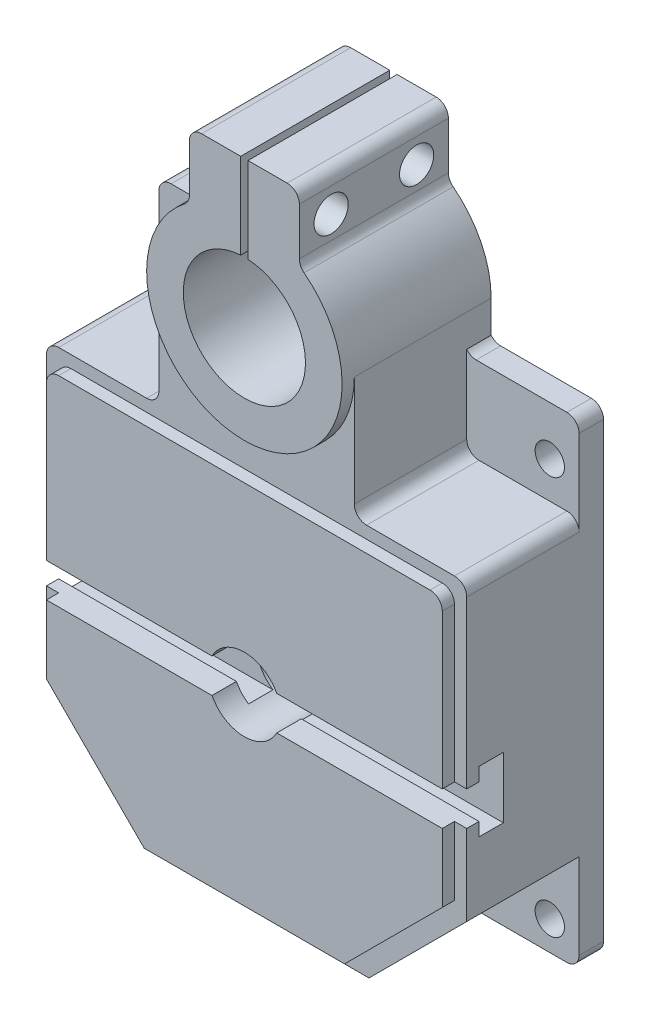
SolidWorks part; units mm, degrees
ref_plane "前视基准面" through (0, 0, 0) normal (0, 0, 1) x (1, 0, 0)
ref_plane "上视基准面" through (0, 0, 0) normal (0, 1, 0) x (1, 0, 0)
ref_plane "右视基准面" through (0, 0, 0) normal (1, 0, 0) x (0, 0, -1)
sketch "草图1" plane through (0, 0, 0) normal (0, 0, 1) x (1, 0, 0)
  line L0 (0, 0) -> (0, 130) construction
  line L1 (0, 0) -> (0, -80) construction
  line L2 (-81, -80) -> (81, -80)
  line L3 (86, -75) -> (86, 110)
  line L4 (81, 115) -> (43.8748, 115)
  line L5 (-86, 110) -> (-86, -75)
  line L6 (0, 130) -> (0, 190) construction
  line L7 (0, 190) -> (17.5, 190)
  line L8 (0, 190) -> (-17.5, 190)
  line L9 (22.5, 185) -> (22.5, 165.6195)
  line L10 (-22.5, 185) -> (-22.5, 165.6195)
  line L11 (-43.8748, 115) -> (-81, 115)
  line L12 (0, 0) -> (-53.3437, 0) construction
  circle A0 centre (0, 130) radius 25
  arc A1 (-86, 110) -> (-81, 115) centre (-81, 110) cw
  arc A2 (81, 115) -> (86, 110) centre (81, 110) cw
  arc A3 (86, -75) -> (81, -80) centre (81, -75) cw
  arc A4 (-81, -80) -> (-86, -75) centre (-81, -75) cw
  arc A5 (-24.4444, 161.6618) -> (-38.9998, 121.1111) centre (0, 130) ccw
  arc A6 (38.9998, 121.1111) -> (24.4444, 161.6618) centre (0, 130) ccw
  arc A7 (17.5, 190) -> (22.5, 185) centre (17.5, 185) cw
  arc A8 (-17.5, 190) -> (-22.5, 185) centre (-17.5, 185) ccw
  arc A9 (-22.5, 165.6195) -> (-24.4444, 161.6618) centre (-27.5, 165.6195) cw
  arc A10 (22.5, 165.6195) -> (24.4444, 161.6618) centre (27.5, 165.6195) ccw
  arc A11 (38.9998, 121.1111) -> (43.8748, 115) centre (43.8748, 120) ccw
  arc A12 (-38.9998, 121.1111) -> (-43.8748, 115) centre (-43.8748, 120) cw
  circle A13 centre (0, 0) radius 15
  circle A14 centre (-74, -68) radius 6
  circle A15 centre (-74, 95) radius 6
  circle A16 centre (74, -68) radius 6
  circle A17 centre (74, 95) radius 6
  point P36 (-37.081, 115)
  dimension "D1" = 5
  dimension "D2" = 5
  dimension "D3" = 74
  dimension "D4" = 74
  dimension "D5" = 68
  dimension "D6" = 95
extrude "凸台-拉伸1" add sketch "草图1" along normal blind 10
sketch "草图2" plane through (0, 0, 10) normal (0, 0, 1) x (1, 0, 0)
  line L0 (-81, -80) -> (81, -80) construction
  line L1 (-46, -80) -> (46, -80)
  line L2 (0, -80) -> (0, 80) construction
  line L3 (-81, 80) -> (-45, 80)
  line L4 (86, -75) -> (86, 110) construction
  line L5 (-86, 110) -> (-86, -75) construction
  line L6 (86, -40) -> (86, 75)
  line L7 (-86, 75) -> (-86, -40)
  line L8 (-86, -40) -> (-46, -80)
  line L9 (46, -80) -> (86, -40)
  line L10 (22.5, 165.6195) -> (22.5, 185) construction
  line L11 (17.5, 190) -> (-17.5, 190) construction
  line L12 (-22.5, 185) -> (-22.5, 165.6195) construction
  line L13 (22.5, 165.6195) -> (22.5, 185)
  line L14 (17.5, 190) -> (-17.5, 190)
  line L15 (-22.5, 185) -> (-22.5, 165.6195)
  line L16 (40, 130) -> (40, 85)
  line L17 (-40, 130) -> (-40, 85)
  line L18 (45, 80) -> (81, 80)
  arc A0 (81, 80) -> (86, 75) centre (81, 75) cw
  arc A1 (-81, 80) -> (-86, 75) centre (-81, 75) ccw
  arc A2 (-24.4444, 161.6618) -> (-22.5, 165.6195) centre (-27.5, 165.6195) ccw construction
  arc A3 (22.5, 165.6195) -> (24.4444, 161.6618) centre (27.5, 165.6195) ccw construction
  arc A4 (22.5, 185) -> (17.5, 190) centre (17.5, 185) ccw construction
  arc A5 (-17.5, 190) -> (-22.5, 185) centre (-17.5, 185) ccw construction
  circle A6 centre (0, 130) radius 25 construction
  arc A7 (-24.4444, 161.6618) -> (-22.5, 165.6195) centre (-27.5, 165.6195) ccw
  arc A8 (22.5, 165.6195) -> (24.4444, 161.6618) centre (27.5, 165.6195) ccw
  arc A9 (22.5, 185) -> (17.5, 190) centre (17.5, 185) ccw
  arc A10 (-17.5, 190) -> (-22.5, 185) centre (-17.5, 185) ccw
  circle A11 centre (0, 130) radius 25
  arc A12 (-24.4444, 161.6618) -> (-40, 130) centre (0, 130) ccw
  arc A13 (40, 130) -> (24.4444, 161.6618) centre (0, 130) ccw
  arc A14 (40, 85) -> (45, 80) centre (45, 85) ccw
  arc A15 (-40, 85) -> (-45, 80) centre (-45, 85) cw
  circle A16 centre (0, 0) radius 15 construction
  circle A17 centre (0, 0) radius 15
  point P17 (-86, -80)
  point P20 (86, -80)
  dimension "D1" = 5
  dimension "D2" = 5
extrude "凸台-拉伸6" add sketch "草图2" along normal blind 46
sketch "草图3" plane through (0, 0, 10) normal (0, 0, -1) x (-1, 0, 0)
  line L0 (-40, 130) -> (-40, 116.84) construction
  line L1 (40, 116.84) -> (40, 130) construction
  line L2 (-40, 130) -> (-40, 116.84)
  line L3 (40, 116.84) -> (40, 130)
  arc A0 (-40, 116.84) -> (-38.9998, 121.1111) centre (-43.8748, 120) ccw construction
  arc A1 (-40, 130) -> (-38.9998, 121.1111) centre (0, 130) ccw construction
  arc A2 (38.9998, 121.1111) -> (40, 130) centre (0, 130) ccw construction
  arc A3 (38.9998, 121.1111) -> (40, 116.84) centre (43.8748, 120) ccw construction
  arc A4 (-40, 116.84) -> (-38.9998, 121.1111) centre (-43.8748, 120) ccw
  arc A5 (-40, 130) -> (-38.9998, 121.1111) centre (0, 130) ccw
  arc A6 (38.9998, 121.1111) -> (40, 130) centre (0, 130) ccw
  arc A7 (38.9998, 121.1111) -> (40, 116.84) centre (43.8748, 120) ccw
extrude "凸台-拉伸7" add sketch "草图3" along normal blind 10
sketch "草图4" plane through (0, 0, 56) normal (0, 0, 1) x (1, 0, 0)
  line L0 (0, 0) -> (81, 0) construction
  line L1 (81, -35) -> (81, 70)
  line L2 (76, 75) -> (-76, 75)
  line L3 (-81, 70) -> (-81, -35)
  line L4 (-41, -75) -> (41, -75)
  line L5 (-81, -35) -> (-41, -75)
  line L6 (41, -75) -> (81, -35)
  line L7 (22.5, 165.6195) -> (22.5, 185) construction
  line L8 (17.5, 190) -> (-17.5, 190) construction
  line L9 (-22.5, 185) -> (-22.5, 165.6195) construction
  line L10 (22.5, 165.6195) -> (22.5, 185)
  line L11 (17.5, 190) -> (-17.5, 190)
  line L12 (-22.5, 185) -> (-22.5, 165.6195)
  arc A0 (-81, 70) -> (-76, 75) centre (-76, 70) cw
  arc A1 (81, 70) -> (76, 75) centre (76, 70) ccw
  arc A2 (-81, -70) -> (-76, -75) centre (-76, -70) ccw
  arc A3 (22.5, 165.6195) -> (24.4444, 161.6618) centre (27.5, 165.6195) ccw construction
  arc A4 (22.5, 185) -> (17.5, 190) centre (17.5, 185) ccw construction
  arc A5 (-17.5, 190) -> (-22.5, 185) centre (-17.5, 185) ccw construction
  arc A6 (-24.4444, 161.6618) -> (-22.5, 165.6195) centre (-27.5, 165.6195) ccw construction
  circle A7 centre (0, 130) radius 25 construction
  circle A8 centre (0, 0) radius 15 construction
  arc A9 (22.5, 165.6195) -> (24.4444, 161.6618) centre (27.5, 165.6195) ccw
  arc A10 (22.5, 185) -> (17.5, 190) centre (17.5, 185) ccw
  arc A11 (-17.5, 190) -> (-22.5, 185) centre (-17.5, 185) ccw
  arc A12 (-24.4444, 161.6618) -> (-22.5, 165.6195) centre (-27.5, 165.6195) ccw
  circle A13 centre (0, 130) radius 25
  circle A14 centre (0, 0) radius 15
  arc A15 (-24.4444, 161.6618) -> (24.4444, 161.6618) centre (0, 130) ccw
  point P7 (81, -75)
  point P15 (-81, -75)
  dimension "D1" = 5
extrude "凸台-拉伸8" add sketch "草图4" along normal blind 5
sketch "草图5" plane through (0, 0, 0) normal (0, 0, -1) x (-1, 0, 0)
  line L0 (0, 0) -> (76, 0) construction
  line L1 (76, 65) -> (76, -30)
  line L2 (36, -70) -> (-36, -70)
  line L3 (-76, -30) -> (-76, 65)
  line L4 (-71, 70) -> (-35, 70)
  line L5 (-36, -70) -> (-76, -30)
  line L6 (76, -30) -> (36, -70)
  line L7 (0, 70) -> (0, 95) construction
  line L8 (0, 95) -> (25, 95)
  line L9 (0, 95) -> (-25, 95)
  line L10 (-30, 90) -> (-30, 75)
  line L11 (30, 90) -> (30, 75)
  line L12 (35, 70) -> (71, 70)
  arc A0 (71, 70) -> (76, 65) centre (71, 65) cw
  arc A1 (-76, 65) -> (-71, 70) centre (-71, 65) cw
  arc A2 (25, 95) -> (30, 90) centre (25, 90) cw
  arc A3 (-30, 90) -> (-25, 95) centre (-25, 90) cw
  arc A4 (30, 75) -> (35, 70) centre (35, 75) ccw
  arc A5 (-30, 75) -> (-35, 70) centre (-35, 75) cw
  point P4 (76, -70)
  point P5 (-76, -70)
  dimension "D1" = 5
  dimension "D2" = 5
extrude "切除-拉伸2" cut sketch "草图5" against normal blind 50
sketch "草图6" plane through (0, 0, 50) normal (0, 0, -1) x (-1, 0, 0)
  line L1 (-76, 20) -> (76, 20)
  line L2 (-76, 20) -> (-76, -20)
  line L3 (-76, -20) -> (76, -20)
  line L4 (76, 20) -> (76, -20)
  line L5 (-76, 20) -> (76, -20) construction
  line L6 (-76, -20) -> (76, 20) construction
  circle A0 centre (0, 0) radius 15 construction
  circle A1 centre (0, 0) radius 15
  point P0 (0, 0)
  dimension "D1" = 40
  dimension "D2" = 152
extrude "凸台-拉伸9" add sketch "草图6" along normal blind 20
fillet "圆角1" radius 10 4 edges at (-76, 20, 40) (-76, -20, 40) (76, -20, 40) (76, 20, 40)
sketch "草图7" plane through (-86, 0, 0) normal (-1, 0, 0) x (0, 0, 1)
  line L2 (0, 0) -> (41, 0) construction
  line L3 (41, 12.5) -> (41, -12.5)
  line L4 (41, -12.5) -> (51, -12.5) construction
  line L5 (51, -12.5) -> (51, -7)
  line L6 (51, -7) -> (62, -7)
  line L7 (51, 12.5) -> (51, 7)
  line L8 (51, 7) -> (62, 7)
  line L9 (51, 12.5) -> (41, 12.5)
  line L10 (41, -12.5) -> (51, -12.5)
  line L11 (62, 7) -> (62, -7)
  dimension "D1" = 11
extrude "切除-拉伸4" cut sketch "草图7" against normal through all contours L3 L10 L5 L6 L8 L7 L9 M9 | L11 L8 L6 M9
sketch "草图8" plane through (0, 190, 0) normal (0, 1, 0) x (1, 0, 0)
  line L0 (0, 0) -> (0, -61) construction
  line L1 (17.5, 0) -> (-17.5, 0) construction
  line L3 (1.5, 0.5) -> (-1.5, 0.5)
  line L4 (1.5, 0.5) -> (1.5, -61.5)
  line L5 (1.5, -61.5) -> (-1.5, -61.5)
  line L6 (-1.5, 0.5) -> (-1.5, -61.5)
  line L7 (1.5, 0.5) -> (-1.5, -61.5) construction
  line L8 (1.5, -61.5) -> (-1.5, 0.5) construction
  point P4 (0, -30.5)
  dimension "D1" = 62
  dimension "D2" = 3
extrude "切除-拉伸5" cut sketch "草图8" against normal blind 40
sketch "草图9" plane through (22.5, 0, 0) normal (1, 0, 0) x (0, 0, -1)
  line L0 (0, 165.6195) -> (0, 185) construction
  line L1 (-61, 165.6195) -> (-61, 185) construction
  line L2 (-61, 190) -> (0, 190) construction
  circle A0 centre (-48, 175) radius 7
  circle A1 centre (-13, 175) radius 7
  dimension "D1" = 13
  dimension "D2" = 13
  dimension "D3" = 15
  dimension "D4" = 15
extrude "切除-拉伸6" cut sketch "草图9" against normal blind 10
sketch "草图10" plane through (12.5, 0, 0) normal (1, 0, 0) x (0, 0, -1)
  circle A0 centre (-48, 175) radius 4.5
  circle A1 centre (-13, 175) radius 4.5
extrude "切除-拉伸7" cut sketch "草图10" against normal up to surface (35 mm away)
sketch "草图11" plane through (-86, 0, 0) normal (-1, 0, 0) x (0, 0, 1)
  line L0 (0, 110) -> (0, -75) construction
  line L1 (56, 80) -> (10, 80) construction
  circle A0 centre (25, 50) radius 11
  dimension "D1" = 25
  dimension "D2" = 30
extrude "切除-拉伸8" cut sketch "草图11" against normal blind 10
sketch "草图12" plane through (0, -80, 0) normal (0, -1, 0) x (1, 0, 0)
  line L0 (-81, 0) -> (81, 0) construction
  line L1 (0, 0) -> (0, 43.5401) construction
  circle A0 centre (32, 33) radius 10
  circle A1 centre (-12, 33) radius 2.5
  circle A2 centre (12, 33) radius 2.5
  dimension "D1" = 33
  dimension "D2" = 33
  dimension "D3" = 33
  dimension "D4" = 32
  dimension "D5" = 12
  dimension "D6" = 24
extrude "切除-拉伸9" cut sketch "草图12" against normal blind 10
